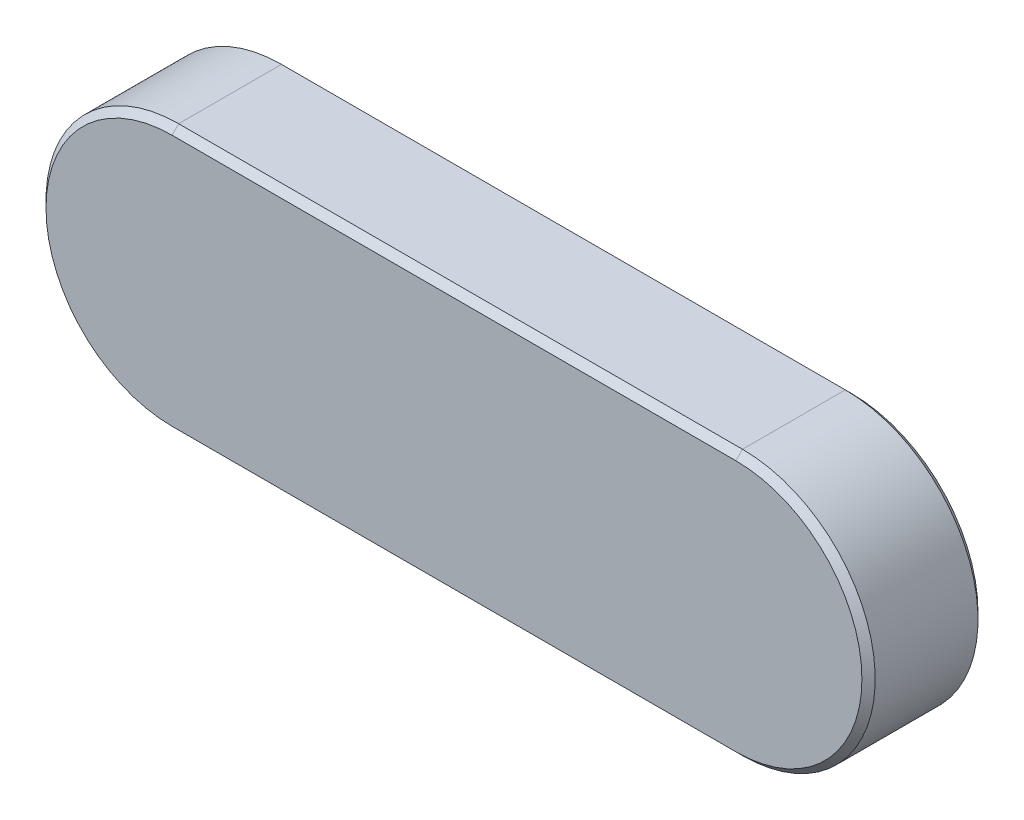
SolidWorks part; units mm, degrees
ref_plane "Front" through (0, 0, 0) normal (0, 0, 1) x (1, 0, 0)
ref_plane "Top" through (0, 0, 0) normal (0, 1, 0) x (1, 0, 0)
ref_plane "Right" through (0, 0, 0) normal (1, 0, 0) x (0, 0, -1)
sketch "Sketch1" plane through (0, 0, 0) normal (0, 0, 1) x (1, 0, 0)
  line L0 (-52.9374, 0) -> (56.5693, 0) construction
  line L1 (0, 11.4129) -> (0, -11.6476) construction
  line L3 (-17, 8) -> (17, 8)
  line L5 (-17, -8) -> (17, -8)
  arc A0 (17, 8) -> (17, -8) centre (17, 0) cw
  arc A1 (-17, 8) -> (-17, -8) centre (-17, 0) ccw
  dimension "b" = 16
  dimension "L" = 50
extrude "BaseKey" add sketch "Sketch1" along normal mid plane 7
sketch "Sketch2" plane through (0, 0, 0) normal (0, 0, 1) x (1, 0, 0)
  line L0 (-25, 8) -> (25, 8)
  line L1 (25, 8) -> (25, -8)
  line L2 (25, 0) -> (0, 0) construction
  line L3 (0, 0) -> (0, 8) construction
  line L4 (-25, -8) -> (25, -8)
  line L5 (-25, 8) -> (-25, -8)
  line L6 (-17, 8) -> (17, 8) construction
  point P8 (0, -8)
  dimension "D1" = 50
  dimension "D2" = 16
extrude "Extrude1" [suppressed] add sketch "Sketch2" along normal mid plane 7
sketch "Sketch3" plane through (0, 0, 0) normal (0, 0, 1) x (1, 0, 0)
  line L0 (-17, -8) -> (25, -8)
  line L1 (-17, 8) -> (25, 8)
  line L2 (25, 8) -> (25, -8)
  line L3 (-25, 0) -> (25, 0) construction
  arc A0 (17, -8) -> (17, 8) centre (17, 0) ccw construction
  arc A1 (-17, 8) -> (-17, -8) centre (-17, 0) ccw
  dimension "D1" = 16
  dimension "D2" = 50
extrude "Extrude2" [suppressed] add sketch "Sketch3" along normal mid plane 7
chamfer "Chamfer1" distance 0.4 angle 45 8 edges at (0, 8, 3.5) (0, 8, -3.5) (0, -8, -3.5) (0, -8, 3.5) (-25, 0, -3.5) (25, 0, -3.5) (-25, 0, 3.5) (25, 0, 3.5)
chamfer "Chamfer2" [suppressed] distance 0.4 angle 45
equation "\"D1@Sketch2\" = \"L@Sketch1\""
equation "\"D2@Sketch2\" = \"b@Sketch1\""
equation "\"D1@Extrude1\" = \"h@BaseKey\""
equation "\"D2@Sketch3\" = \"L@Sketch1\""
equation "\"D1@Sketch3\" = \"b@Sketch1\""
equation "\"D1@Extrude2\" = \"h@BaseKey\""
